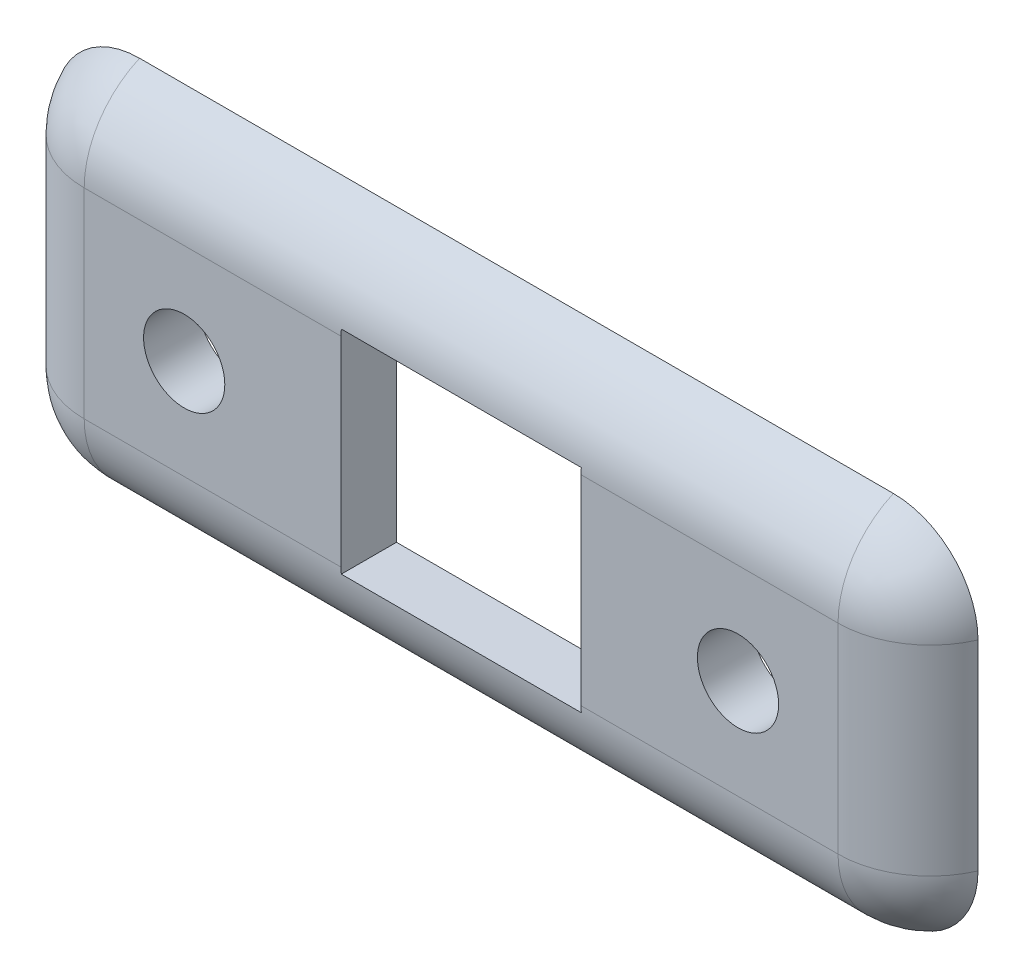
SolidWorks part; units mm, degrees
ref_plane "Plan de face" through (0, 0, 0) normal (0, 0, 1) x (1, 0, 0)
ref_plane "Plan de dessus" through (0, 0, 0) normal (0, 1, 0) x (1, 0, 0)
ref_plane "Plan de droite" through (0, 0, 0) normal (1, 0, 0) x (0, 0, -1)
sketch "Esquisse1" plane through (0, 0, 0) normal (0, 0, 1) x (1, 0, 0)
  line L1 (24.0422, -4.0649) -> (-25.9578, -4.0649)
  line L2 (24.0422, -4.0649) -> (24.0422, 15.9351)
  line L3 (24.0422, 15.9351) -> (-25.9578, 15.9351)
  line L4 (-25.9578, -4.0649) -> (-25.9578, 15.9351)
  dimension "D1" = 50
  dimension "D2" = 20
extrude "Boss.-Extru.1" add sketch "Esquisse1" along normal blind 3
sketch "Esquisse2" plane through (0, 0, 3) normal (0, 0, 1) x (1, 0, 0)
  line L0 (24.0422, 15.9351) -> (-25.9578, 15.9351) construction
  line L1 (-7.4578, 11.6851) -> (5.5422, 11.6851)
  line L2 (-7.4578, 11.6851) -> (-7.4578, 0.1851)
  line L3 (-7.4578, 0.1851) -> (5.5422, 0.1851)
  line L4 (5.5422, 11.6851) -> (5.5422, 0.1851)
  line L5 (-25.9578, 15.9351) -> (-25.9578, -4.0649) construction
  point P6 (-0.9578, 11.6851)
  point P7 (-7.4578, 5.9351)
  dimension "D1" = 13
  dimension "D2" = 11.5
  dimension "D3" = 4.25
  dimension "D4" = 18.5
extrude "Enlèv. mat.-Extru.1" cut sketch "Esquisse2" against normal through all
sketch "Esquisse3" plane through (0, 0, 3) normal (0, 0, 1) x (1, 0, 0)
  line L0 (-25.9578, 15.9351) -> (-25.9578, -4.0649) construction
  line L1 (24.0422, 15.9351) -> (-25.9578, 15.9351) construction
  circle A0 centre (-15.9578, 5.9351) radius 2.2
  circle A1 centre (14.0422, 5.9351) radius 2.2
  dimension "D5" = 4.4
  dimension "D6" = 4.4
  dimension "D1" = 10
  dimension "D2" = 10
  dimension "D4" = 30
  dimension "D3" = 2
extrude "Enlèv. mat.-Extru.2" cut sketch "Esquisse3" against normal through all
fillet "Congé3" radius 5 4 edges at (-0.9578, -4.0649, 3) (24.0422, 5.9351, 3) (-0.9578, 15.9351, 3) (-25.9578, 5.9351, 3)
fillet "Congé4" radius 5 4 edges at (22.1982, -2.2209, 2.1833) (22.1982, 14.0912, 2.1833) (-24.1138, 14.0912, 2.1833) (-24.1138, -2.2209, 2.1833)
fillet "Congé1" radius 5
fillet "Congé2" radius 5
